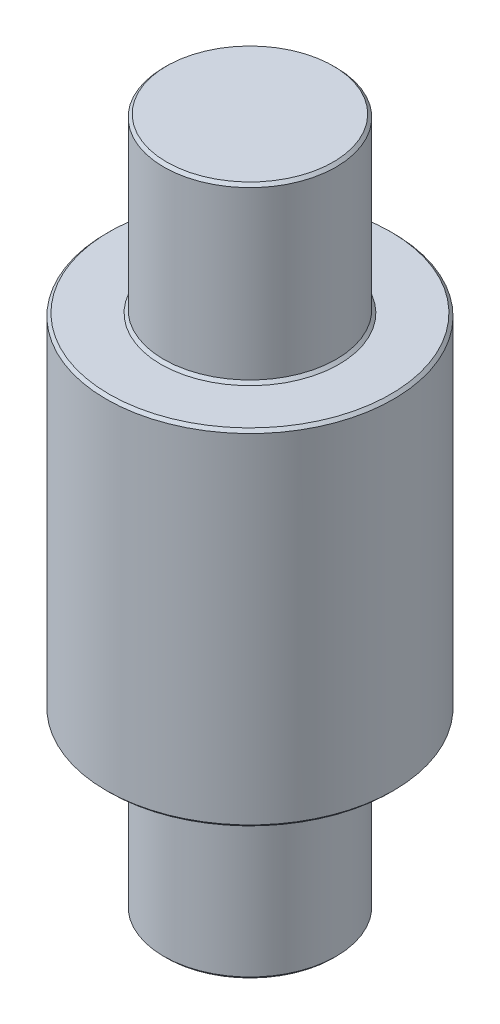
SolidWorks part; units mm, degrees
ref_plane "Спереди" through (0, 0, 0) normal (0, 0, 1) x (1, 0, 0)
ref_plane "Сверху" through (0, 0, 0) normal (0, 1, 0) x (1, 0, 0)
ref_plane "Справа" through (0, 0, 0) normal (1, 0, 0) x (0, 0, -1)
sketch "Эскиз1" plane through (0, 0, 0) normal (0, 0, 1) x (1, 0, 0)
  line L0 (0, 60) -> (0, -60)
  line L1 (0, 60) -> (-15, 60)
  line L2 (-15, 60) -> (-15, 30)
  line L3 (-15, 30) -> (-25, 30)
  line L4 (-25, 30) -> (-25, -30)
  line L5 (-25, -30) -> (-15, -30)
  line L6 (-15, -30) -> (-15, -60)
  line L7 (-15, -60) -> (0, -60)
  dimension "D1" = 60
  dimension "D2" = 30
  dimension "D3" = 15
  dimension "D4" = 25
revolve "Повернуть1" add sketch "Эскиз1" angle 360 about L0
chamfer "Фаска1" distance 0.5 angle 45 6 edges at (0, 30, 25) (0, -30, 25) (0, -30, 15) (0, -60, 15) (0, 60, 15) (0, 30, 15)
